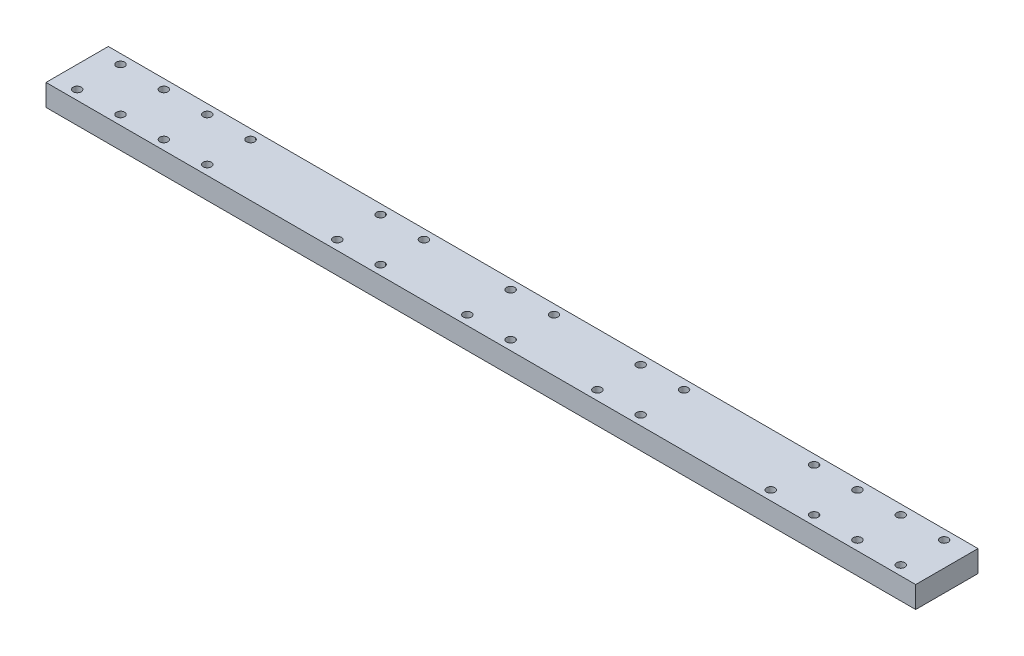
SolidWorks part; units mm, degrees
ref_plane "前视基准面" through (0, 0, 0) normal (0, 0, 1) x (1, 0, 0)
ref_plane "上视基准面" through (0, 0, 0) normal (0, 1, 0) x (1, 0, 0)
ref_plane "右视基准面" through (0, 0, 0) normal (1, 0, 0) x (0, 0, -1)
sketch "草图1" plane through (0, 0, 0) normal (0, 1, 0) x (1, 0, 0)
  line L1 (-22.2954, 10.1388) -> (298.7046, 10.1388)
  line L2 (-22.2954, 10.1388) -> (-22.2954, -12.8612)
  line L3 (-22.2954, -12.8612) -> (298.7046, -12.8612)
  line L4 (298.7046, 10.1388) -> (298.7046, -12.8612)
  circle A0 centre (-14.2954, 6.6388) radius 1.5
  circle A1 centre (1.7046, 6.6388) radius 1.5
  circle A2 centre (17.7046, 6.6388) radius 1.5
  circle A3 centre (33.7046, 6.6388) radius 1.5
  circle A4 centre (-14.2954, -9.3612) radius 1.5
  circle A5 centre (1.7046, -9.3612) radius 1.5
  circle A6 centre (17.7046, -9.3612) radius 1.5
  circle A7 centre (33.7046, -9.3612) radius 1.5
  circle A8 centre (81.7046, 6.6388) radius 1.5
  circle A9 centre (97.7046, 6.6388) radius 1.5
  circle A10 centre (81.7046, -9.3612) radius 1.5
  circle A11 centre (97.7046, -9.3612) radius 1.5
  circle A12 centre (129.7046, 6.6388) radius 1.5
  circle A13 centre (145.7046, 6.6388) radius 1.5
  circle A14 centre (129.7046, -9.3612) radius 1.5
  circle A15 centre (145.7046, -9.3612) radius 1.5
  circle A16 centre (177.7046, 6.6388) radius 1.5
  circle A17 centre (193.7046, 6.6388) radius 1.5
  circle A18 centre (177.7046, -9.3612) radius 1.5
  circle A19 centre (193.7046, -9.3612) radius 1.5
  circle A28 centre (241.7046, 6.6388) radius 1.5
  circle A29 centre (257.7046, 6.6388) radius 1.5
  circle A30 centre (241.7046, -9.3612) radius 1.5
  circle A31 centre (257.7046, -9.3612) radius 1.5
  circle A32 centre (273.7046, 6.6388) radius 1.5
  circle A33 centre (289.7046, 6.6388) radius 1.5
  circle A34 centre (273.7046, -9.3612) radius 1.5
  circle A35 centre (289.7046, -9.3612) radius 1.5
  dimension "D3" = 8
  dimension "D1" = 23
  dimension "D2" = 321
  dimension "D4" = 3.5
  dimension "D12" = 16
  dimension "D11" = 48
  dimension "D13" = 32
  dimension "D15" = 48
  dimension "D5" = 2
  dimension "D6" = 2
  dimension "D7" = 2
  dimension "D8" = 2
  dimension "D9" = 2
  dimension "D10" = 2
  dimension "D14" = 2
  dimension "D16" = 2
extrude "凸台-拉伸1" add sketch "草图1" along normal blind 8
